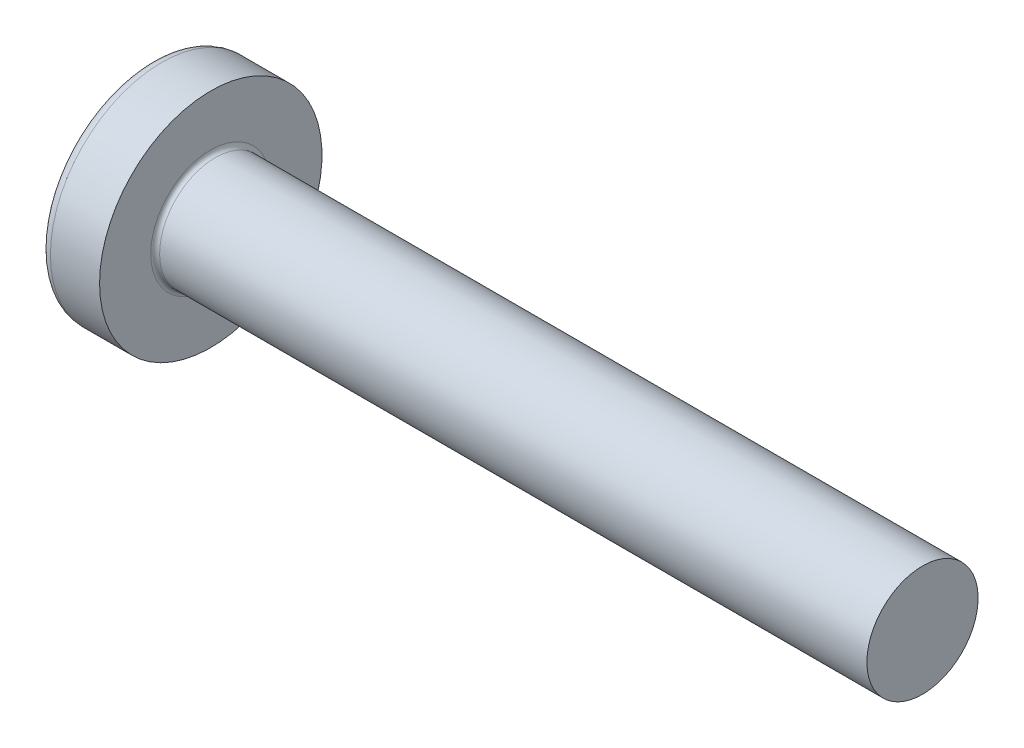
SolidWorks part; units mm, degrees
ref_plane "Plane1" through (0, 0, 0) normal (0, 0, 1) x (1, 0, 0)
ref_plane "Plane2" through (0, 0, 0) normal (0, 1, 0) x (1, 0, 0)
ref_plane "Plane3" through (0, 0, 0) normal (1, 0, 0) x (0, 0, -1)
revolve "Base-Revolve" add sketch "BodySke"
sketch "BodySke" plane through (0, 0, 0) normal (0, 0, 1) x (1, 0, 0)
  line L0 (2.1, 1.25) -> (2.1, 2.5)
  line L1 (2.325, 6.35) -> (2.325, -3.175) construction
  line L2 (-25.4, 0) -> (127, 0) construction
  line L3 (18.1, 0) -> (0, 0)
  line L4 (2.1, 1.25) -> (18.1, 1.25)
  line L5 (18.1, 1.25) -> (18.1, 0)
  line L6 (0.995, 2.5) -> (2.1, 2.5)
  line L8 (8.1, 6.35) -> (8.1, -3.175) construction
  arc A0 (0.8032, 2.4043) -> (0, 0) centre (4, 0) ccw
  arc A2 (0.8032, 2.4043) -> (0.995, 2.5) centre (0.995, 2.26) cw
  dimension "Head_fillet_rad" = 0.24
  dimension "Head_crown_rad" = 4
  dimension "Head_ht" = 2.1
  dimension "Diameter" = 2.5
  dimension "Length" = 16
  dimension "Head_dia" = 5
  dimension "Advance" = 0.45
  dimension "Thread_nom" = 10
fillet "Fillet1" radius 0.1 1 edges at (2.1, 0, 1.25)
sketch "Sketch3" plane through (0, 0, 0) normal (1, 0, 0) x (0, 0, -1)
  line L0 (0.37, -1.3) -> (-0.37, -1.3)
  line L1 (0.37, -1.3) -> (0.37, 1.3)
  line L2 (-0.37, 1.3) -> (0.37, 1.3)
  line L3 (-0.37, 1.3) -> (-0.37, -1.3)
  dimension "D1" = 1.3
  dimension "Cross_dia" = 2.6
  dimension "D2" = 0.37
  dimension "Cross_width" = 0.74
ref_plane "Plane4" through (1.5, 0, 0) normal (1, 0, 0) x (0, 0, -1)
sketch "Sketch4" plane through (1.5, 0, 0) normal (1, 0, 0) x (0, 0, -1)
  line L0 (0.37, -0.5521) -> (-0.37, -0.5521)
  line L1 (0.37, -0.5521) -> (0.37, 0.5521)
  line L2 (-0.37, 0.5521) -> (0.37, 0.5521)
  line L3 (-0.37, 0.5521) -> (-0.37, -0.5521)
  dimension "D1" = 0.74
  dimension "D2" = 1.1043
  dimension "D3" = 0.37
  dimension "D4" = 0.5521
loft "Recess" cut profiles "Sketch3", "Sketch4"
pattern_circular "RecPat" count 2 every 90 about axis through (0, 0, 0) along (1, 0, 0) of "Recess"
sketch "RecCorSke" plane through (0, 0, 0) normal (0, 0, 1) x (1, 0, 0)
  line L0 (-3.175, 0) -> (15.875, 0) construction
  line L1 (-25.4, 0) -> (127, 0) construction
  line L2 (0, 0) -> (0, 0.6609)
  line L3 (0, 0.6609) -> (1.5, 0.556)
  line L4 (1.5, 0.556) -> (1.6807, 0)
  line L5 (1.6807, 0) -> (0, 0)
  dimension "Diameter" = 1.112
  dimension "Depth" = 1.5
  dimension "Draft_angle" = 4
  dimension "Bottom_angle" = 18
revolve "RecessCore" cut sketch "RecCorSke" angle 360 about L0
sketch "ThdSchSke" plane through (0, 0, 0) normal (0, 0, 1) x (1, 0, 0)
  line L0 (8.1, -0.9965) -> (7.9225, -1.25)
  line L1 (8.1, -0.9965) -> (8.2775, -1.25)
  line L2 (8.2775, -1.25) -> (8.2775, -1.5625)
  line L3 (-3.175, 0) -> (5.1513, 0) construction
  line L5 (8.2775, -1.5625) -> (7.9225, -1.5625)
  line L6 (7.9225, -1.5625) -> (7.9225, -1.25)
  dimension "Thread_minor" = 1.993
  dimension "Diameter" = 2.5
  dimension "Start" = 8.1
  dimension "SideAngle" = 55
  dimension "VeeAngle" = 70
  dimension "Overcut" = 3.125
revolve "ThreadSchematic" cut sketch "ThdSchSke" angle 360 about L3
pattern_linear "ThdSchPat"
equation "\"D1@Sketch3\" = \"Cross_dia@Sketch3\" / 2"
equation "\"D2@Sketch3\" = \"Cross_width@Sketch3\" / 2"
equation "\"Depth@RecCorSke\" = \"Cross_depth@Plane4\""
equation "\"D1@Sketch4\" = \"Cross_width@Sketch3\""
equation "\"D2@Sketch4\" = \"Cross_dia@Sketch3\" - 2.0 * \"Cross_depth@Plane4\" * tan(26.5  * 0.017453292)"
equation "\"D3@Sketch4\" = \"D1@Sketch4\" / 2"
equation "\"D4@Sketch4\" = \"D2@Sketch4\" / 2"
equation "\"Thread_length@ThreadCosmetic\" = ((sgn( (\"Length@BodySke\" - \"Advance@BodySke\" * 2.0 ) - \"Thread_nom@BodySke\" )-1)*( (\"Length@BodySke\" - \"Advance@BodySke\" * 2.0 ) - \"Thread_nom@BodySke\" ))/-2+ \"Thread_"
equation "\"Thread_minor@ThdSchSke\" = \"Thread_minor@ThreadCosmetic\""
equation "\"Diameter@ThdSchSke\" = \"Diameter@BodySke\""
equation "\"Overcut@ThdSchSke\" = \"Diameter@BodySke\" * 1.25"
equation "\"Start@ThdSchSke\" = \"Head_ht@BodySke\" + \"Length@BodySke\" - \"Thread_length@ThreadCosmetic\"  '---Non-countersunk---"
equation "\"Num_threads@ThdSchPat\" = int( \"Thread_length@ThreadCosmetic\" / \"Advance@BodySke\" + 0.999 )  + 1"
equation "\"Advance@ThdSchPat\" = \"Thread_length@ThreadCosmetic\" /  (\"Num_threads@ThdSchPat\" - 1) 'relax it"
